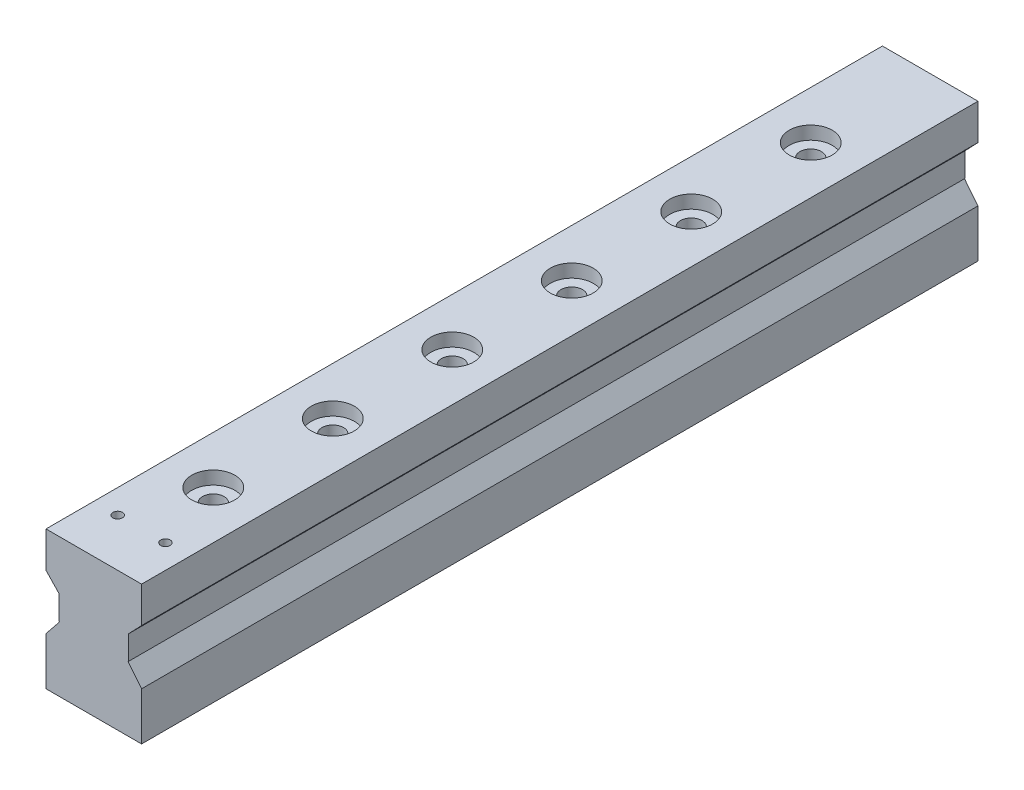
SolidWorks part; units mm, degrees
ref_plane "Płaszczyzna przednia" through (0, 0, 0) normal (0, 0, 1) x (1, 0, 0)
ref_plane "Płaszczyzna górna" through (0, 0, 0) normal (0, 1, 0) x (1, 0, 0)
ref_plane "Płaszczyzna prawa" through (0, 0, 0) normal (1, 0, 0) x (0, 0, -1)
sketch "Szkic1" plane through (0, 0, 0) normal (0, 0, 1) x (1, 0, 0)
  line L0 (32.8077, 43.2312) -> (-7.1923, 43.2312)
  line L1 (-7.1923, 43.2312) -> (-7.1923, 28.2312)
  line L4 (-1.6923, 22.4619) -> (-1.6923, 12.4619)
  line L5 (-1.6923, 12.4619) -> (-1.4231, 12.4619)
  line L6 (-1.4231, 12.4619) -> (-7.1923, 5.2941)
  line L7 (-7.1923, 5.2941) -> (-7.1923, -14.7059)
  line L8 (-7.1923, -14.7059) -> (32.8077, -14.7059)
  line L9 (12.8077, -14.7059) -> (12.8077, 43.2312) construction
  line L10 (32.8077, 5.2941) -> (32.8077, -14.7059)
  line L11 (27.0385, 12.4619) -> (32.8077, 5.2941)
  line L12 (27.3077, 12.4619) -> (27.0385, 12.4619)
  line L13 (27.3077, 22.4619) -> (27.3077, 12.4619)
  line L16 (32.8077, 43.2312) -> (32.8077, 28.2312)
  line L17 (32.8077, 28.2312) -> (27.3077, 22.4619)
  line L18 (-1.6923, 22.4619) -> (-7.1923, 28.2312)
  dimension "D1" = 40
  dimension "D2" = 15
  dimension "D3" = 10
  dimension "D4" = 20
  dimension "D5" = 29
  dimension "D6" = 40
extrude "Dodanie-wyciągnięcie1" add sketch "Szkic1" along normal blind 350
hole_wizard "Pogłębienie walcowe pod M8 Wkręt z łbem sześciokątnym z gniazdem1" positions "Szkic3" profile "Szkic2" counterbore size "M8" standard "Ansi Metric"
sketch "Szkic3" plane through (0, 43.2312, 0) normal (0, 1, 0) x (1, 0, 0)
  line L0 (32.8077, 0) -> (-7.1923, 0) construction
  line L1 (32.8077, -350) -> (32.8077, 0) construction
  point P0 (12.8077, -50)
  dimension "D1" = 50
  dimension "D2" = 20
sketch "Szkic2" plane through (12.8077, 43.2312, 50) normal (1, 0, 0) x (0, 0, 1)
  line L0 (0, 0) -> (0, 57.9371)
  line L1 (0, 57.9371) -> (4.5, 57.9371)
  line L3 (4.5, 57.9371) -> (4.5, 5.5)
  line L4 (4.5, 5.5) -> (9.005, 5.5)
  line L5 (9.005, 5.5) -> (9.005, 0)
  line L7 (9.005, 0) -> (0, 0)
  line L11 (0, -6.35) -> (0, 107.95) construction
  dimension "Średnica otworu na wylot" = 9
  dimension "Głębokość otworu na wylot" = 57.9371
  dimension "Średnica pogłębienia walcowego" = 18.01
  dimension "Głębokość pogłębienia walcowego" = 5.5
pattern_linear "Szyk liniowy1" count 6 spacing 50 along (0, 0, 1) of "Pogłębienie walcowe pod M8 Wkręt z łbem sześciokątnym z gniazdem1"
ref_plane "Płaszczyzna3" through (12.8077, 0, 0) normal (-1, 0, 0) x (0, 0, 1)
hole_wizard "Otwory ustalające Ø4.0mm2" positions "Szkic7" profile "Szkic6" hole size "Ø4.0" standard "Ansi Metric"
sketch "Szkic7" plane through (0, 43.2312, 0) normal (0, 1, 0) x (1, 0, 0)
  line L0 (32.8077, -350) -> (-7.1923, -350) construction
  line L1 (32.8077, -350) -> (32.8077, 0) construction
  point P0 (22.8077, -330)
  dimension "D1" = 20
  dimension "D2" = 10
sketch "Szkic6" plane through (22.8077, 43.2312, 330) normal (1, 0, 0) x (0, 0, 1)
  line L0 (0, 0) -> (0, 11.2017)
  line L1 (0, 11.2017) -> (2, 10)
  line L2 (2, 10) -> (2, 0)
  line L5 (2, 0) -> (0, 0)
  line L10 (0, 11.2017) -> (-2, 10) construction
  line L11 (0, -6.35) -> (0, 107.95) construction
  dimension "Średnica otworu" = 4
  dimension "Głębokość otworu" = 10
  dimension "Kąt wiertła" = 118
pattern_linear "Szyk liniowy2" count 2 spacing 20 along (-1, 0, 0) of "Otwory ustalające Ø4.0mm2"
